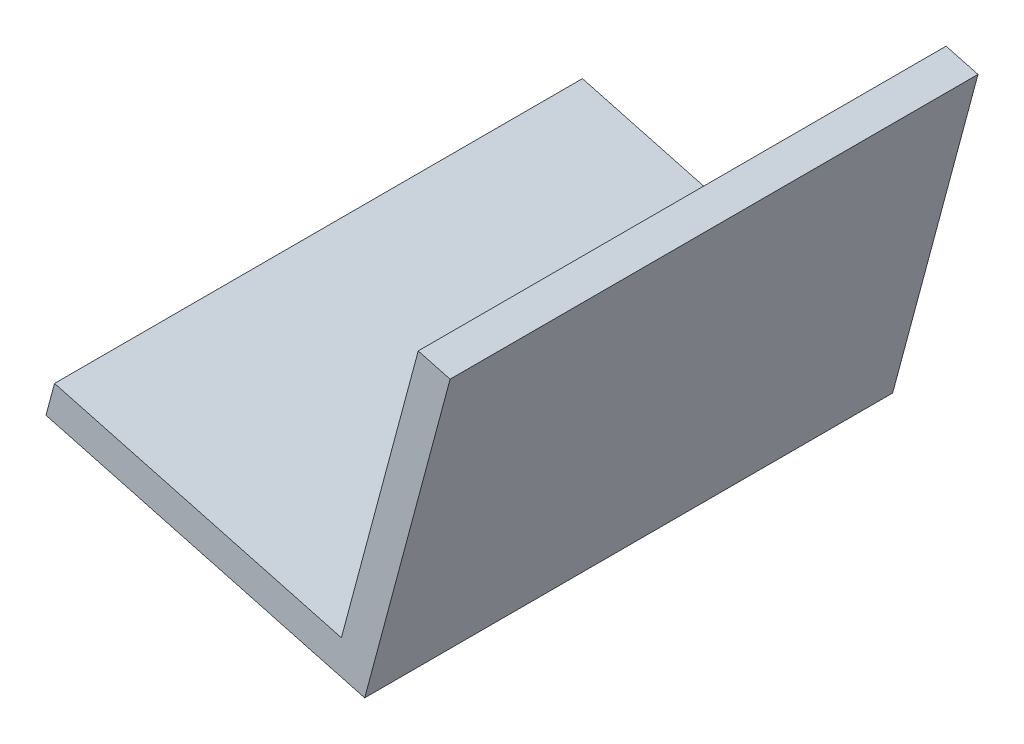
SolidWorks part; units mm, degrees
ref_plane "Face" through (0, 0, 0) normal (0, 0, 1) x (1, 0, 0)
ref_plane "Dessus" through (0, 0, 0) normal (0, 1, 0) x (1, 0, 0)
ref_plane "Droite" through (0, 0, 0) normal (1, 0, 0) x (0, 0, -1)
sketch "Esquisse1" plane through (0, 0, 0) normal (0, 0, 1) x (1, 0, 0)
  line L0 (3667.9923, 3525.279) -> (3672.8219, 3523.9849)
  line L1 (3672.8219, 3523.9849) -> (3659.881, 3475.6886)
  line L2 (3659.881, 3475.6886) -> (3611.5847, 3488.6296)
  line L3 (3611.5847, 3488.6296) -> (3612.8788, 3493.4592)
  line L4 (3612.8788, 3493.4592) -> (3656.3454, 3481.8124)
  line L5 (3656.3454, 3481.8124) -> (3667.9923, 3525.279)
extrude "Base-Extrusion" add sketch "Esquisse1" against normal blind 80
